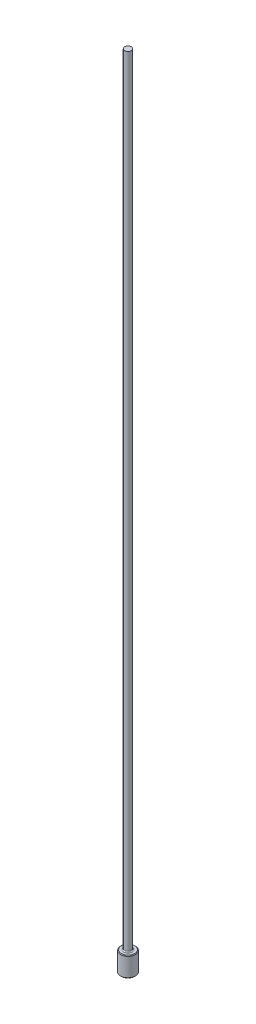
SolidWorks part; units mm, degrees
ref_plane "Front Plane" through (0, 0, 0) normal (0, 0, 1) x (1, 0, 0)
ref_plane "Top Plane" through (0, 0, 0) normal (0, 1, 0) x (1, 0, 0)
ref_plane "Right Plane" through (0, 0, 0) normal (1, 0, 0) x (0, 0, -1)
other "Configuration Table"
sketch "Sketch1" plane through (0, 0, 0) normal (0, 0, 1) x (1, 0, 0)
  line L0 (0, 259.9588) -> (0, -15.1925) construction
  line L1 (0, 0) -> (-0.5842, 0)
  line L2 (-0.5842, 0) -> (-0.5842, 1.5748)
  line L3 (-0.5842, 1.5748) -> (-0.2667, 1.5748)
  line L4 (-0.2667, 1.5748) -> (-0.2667, 63.5)
  line L5 (-0.2667, 63.5) -> (0, 63.5)
  line L6 (0, 63.5) -> (0, 0)
  dimension "L" = 63.5
  dimension "H" = 1.1684
  dimension "T" = 1.5748
  dimension "D" = 0.5334
revolve "Revolve1" add sketch "Sketch1" angle 360 about L0
chamfer "Chamfer1" distance 0.0508 angle 45 2 edges at (0, 1.5748, 0.5842) (0, 0, 0.5842)
fillet "Fillet1" radius 0.0762 1 edges at (0, 1.5748, 0.2667)
